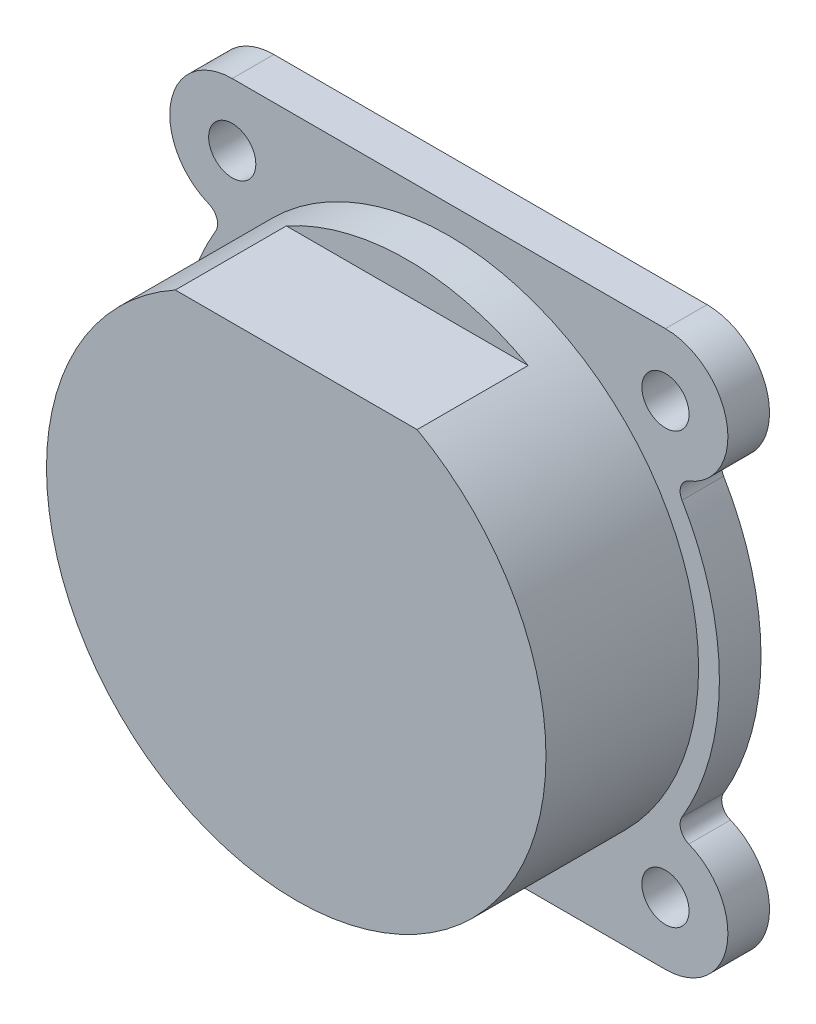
SolidWorks part; units mm, degrees
ref_plane "Plan1" through (0, 0, 0) normal (0, 0, 1) x (1, 0, 0)
ref_plane "Plan2" through (0, 0, 0) normal (0, 1, 0) x (1, 0, 0)
ref_plane "Plan3" through (0, 0, 0) normal (1, 0, 0) x (0, 0, -1)
sketch "Esquisse1" plane through (0, 0, 0) normal (0, 0, 1) x (1, 0, 0)
  line L0 (0, 24.7958) -> (0, -28.468) construction
  line L1 (15.6125, 20) -> (-15.6125, 20)
  line L2 (-15.6125, -20) -> (15.6125, -20)
  arc A0 (-16.8053, -9.891) -> (-16.8053, 9.891) centre (0, 0) cw
  arc A1 (17.2936, 11.3258) -> (15.6125, 20) centre (15.6125, 15.5) ccw
  arc A2 (-16.8053, -9.891) -> (-17.2936, -11.3258) centre (-17.6671, -10.3982) cw
  arc A3 (17.2936, 11.3258) -> (16.8053, 9.891) centre (17.6671, 10.3982) ccw
  arc A4 (-15.6125, -20) -> (-17.2936, -11.3258) centre (-15.6125, -15.5) cw
  arc A5 (-17.2936, 11.3258) -> (-16.8053, 9.891) centre (-17.6671, 10.3982) cw
  arc A6 (-17.2936, 11.3258) -> (-15.6125, 20) centre (-15.6125, 15.5) cw
  arc A7 (15.6125, -20) -> (17.2936, -11.3258) centre (15.6125, -15.5) ccw
  arc A8 (16.8053, -9.891) -> (17.2936, -11.3258) centre (17.6671, -10.3982) ccw
  arc A9 (16.8053, -9.891) -> (16.8053, 9.891) centre (0, 0) ccw
  point P27 (0, 20)
  dimension "D1" = 4.5
  dimension "D2" = 19.5
  dimension "D3" = 4.5
  dimension "D4" = 1
  dimension "D5" = 1
  dimension "D14" = 15.5
  dimension "D15" = 15.6125
  dimension "D6" = 20
  dimension "D8" = 15.6125
  dimension "D9" = 15.5
  dimension "D10" = 17.6671
  dimension "D11" = 10.3982
  dimension "D12" = 17.6671
  dimension "D13" = 10.3982
extrude "Base-Extrusion" add sketch "Esquisse1" along normal blind 14
sketch "Esquisse2" plane through (0, 0, 14) normal (0, 0, 1) x (1, 0, 0)
  circle A0 centre (0, 0) radius 18
  circle A1 centre (0, 0) radius 40
  dimension "D1" = 36
  dimension "D2" = 80
extrude "Enlèv. mat.-Extru.1" cut sketch "Esquisse2" against normal blind 11
hole_wizard "Perçage1" positions "Esquisse4" profile "Esquisse3" hole size "M3" standard "ISO"
sketch "Esquisse4" plane through (0, 0, 3) normal (0, 0, 1) x (1, 0, 0)
  arc A0 (-17.2936, -11.3258) -> (-15.6125, -20) centre (-15.6125, -15.5) ccw construction
  arc A1 (15.6125, -20) -> (17.2936, -11.3258) centre (15.6125, -15.5) ccw construction
  arc A2 (17.2936, 11.3258) -> (15.6125, 20) centre (15.6125, 15.5) ccw construction
  arc A3 (-15.6125, 20) -> (-17.2936, 11.3258) centre (-15.6125, 15.5) ccw construction
  point P0 (15.6125, 15.5)
  point P1 (15.6125, -15.5)
  point P2 (-15.6125, 15.5)
  point P3 (-15.6125, -15.5)
sketch "Esquisse3" plane through (15.6125, 15.5, 3) normal (1, 0, 0) x (0, -1, 0)
  line L0 (0, 0) -> (0, 81.0215)
  line L1 (0, 81.0215) -> (1.7, 80)
  line L2 (1.7, 80) -> (1.7, 0)
  line L5 (1.7, 0) -> (0, 0)
  line L10 (0, 81.0215) -> (-1.7, 80) construction
  line L11 (0, -6.35) -> (0, 107.95) construction
  dimension "Diamètre du perçage" = 3.4
  dimension "Profondeur du perçage" = 80
  dimension "Angle de pointe" = 118
sketch "Esquisse5" plane through (0, 0, 0) normal (0, 0, -1) x (-1, 0, 0)
  circle A0 centre (0, 0) radius 15
  dimension "D1" = 30
extrude "Enlèv. mat.-Extru.2" cut sketch "Esquisse5" against normal blind 11
ref_plane "Plan4" through (0, 15.75, 0) normal (0, 1, 0) x (-1, 0, 0)
sketch "Esquisse6" plane through (0, 15.75, 0) normal (0, 1, 0) x (-1, 0, 0)
  line L0 (18, 14) -> (-18, 14) construction
  line L1 (20, 14) -> (-20, 14)
  line L2 (20, 14) -> (20, 6)
  line L3 (20, 6) -> (-20, 6)
  line L4 (-20, 14) -> (-20, 6)
  dimension "D1" = 8
  dimension "D2" = 40
  dimension "D3" = 20
extrude "Enlèv. mat.-Extru.3" cut sketch "Esquisse6" along normal through all
sketch "Esquisse7" plane through (0, 0, 14) normal (0, 0, 1) x (1, 0, 0)
  line L1 (-27.3, 24.9) -> (0, 24.9)
  line L2 (-27.3, 24.9) -> (-27.3, -31)
  line L3 (-27.3, -31) -> (0, -31)
  line L4 (0, 24.9) -> (0, -31)
extrude "Enlèv. mat.-Extru.4" [suppressed] cut sketch "Esquisse7" against normal through all
